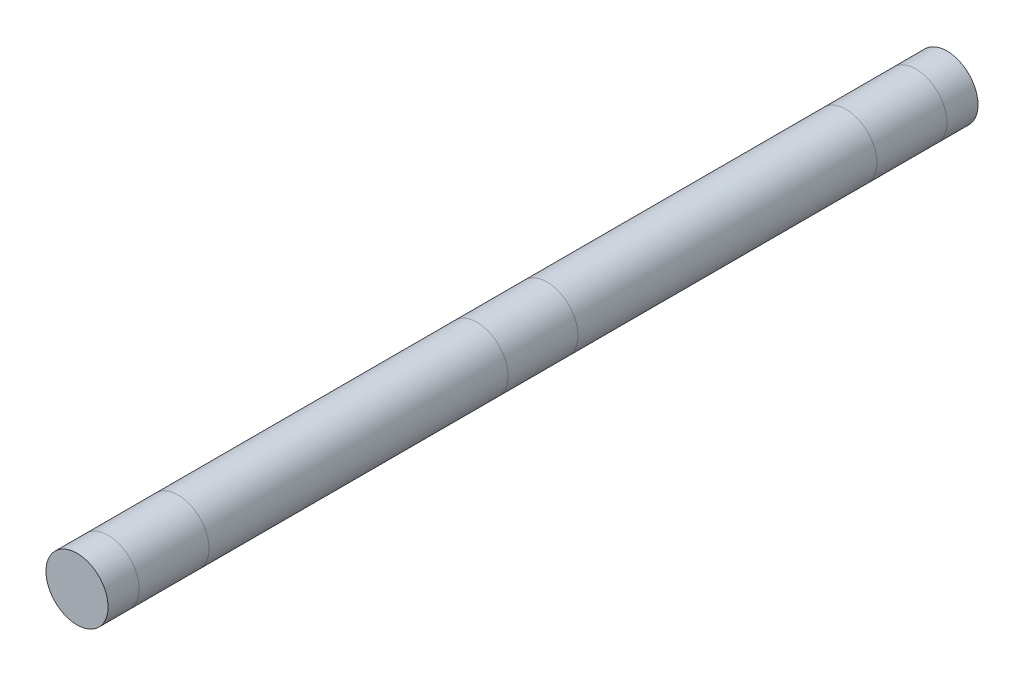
SolidWorks part; units mm, degrees
ref_plane "Front Plane" through (0, 0, 0) normal (0, 0, 1) x (1, 0, 0)
ref_plane "Top Plane" through (0, 0, 0) normal (0, 1, 0) x (1, 0, 0)
ref_plane "Right Plane" through (0, 0, 0) normal (1, 0, 0) x (0, 0, -1)
sketch "Sketch1" plane through (0, 0, 0) normal (0, 0, 1) x (1, 0, 0)
  circle A0 centre (0, 0) radius 25.4
  dimension "D1" = 50.8
extrude "Extrude1" add sketch "Sketch1" along normal blind 711.2
sketch "Sketch2" plane through (0, 0, 0) normal (0, 1, 0) x (1, 0, 0)
  line L0 (-25.4, -25.4) -> (25.4, -25.4)
  line L1 (25.4, -25.4) -> (25.4, -82.55)
  line L2 (25.4, -82.55) -> (-25.4, -82.55)
  line L3 (-25.4, -82.55) -> (-25.4, -327.025)
  line L4 (-25.4, -327.025) -> (25.4, -327.025)
  line L5 (25.4, -327.025) -> (25.4, -384.175)
  line L6 (25.4, -384.175) -> (-25.4, -384.175)
  line L7 (-25.4, -384.175) -> (-25.4, -628.65)
  line L8 (-25.4, -628.65) -> (25.4, -628.65)
  line L9 (25.4, -628.65) -> (25.4, -685.8)
  line L10 (25.4, -685.8) -> (-25.4, -685.8)
  line L11 (25.4, -355.6) -> (-158.318, -355.6) construction
  line L12 (25.4, -711.2) -> (25.4, 0) construction
  line L13 (25.4, 0) -> (-25.4, 0) construction
  line L14 (-25.4, -711.2) -> (25.4, -711.2) construction
  line L15 (-25.4, 0) -> (-25.4, -711.2) construction
  dimension "D1" = 25.4
  dimension "D2" = 25.4
  dimension "D3" = 57.15
